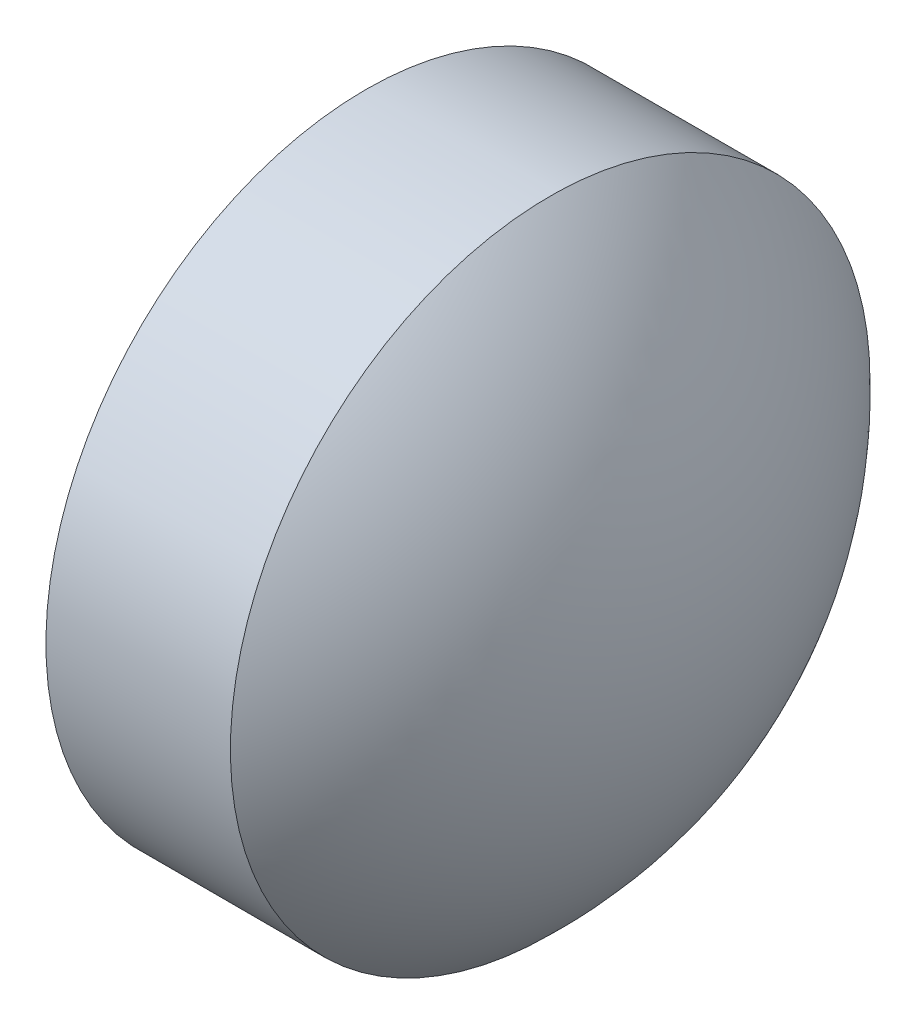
SolidWorks part; units mm, degrees
ref_plane "Vorne" through (0, 0, 0) normal (0, 0, 1) x (1, 0, 0)
ref_plane "Oben" through (0, 0, 0) normal (0, 1, 0) x (1, 0, 0)
ref_plane "Rechts" through (0, 0, 0) normal (1, 0, 0) x (0, 0, -1)
sketch "Skizze1" plane through (0, 0, 0) normal (0, 0, 1) x (1, 0, 0)
  line L0 (0, 0) -> (12.445, 0) construction
  line L1 (0.4954, 1.75) -> (1.505, 1.75) construction
  line L2 (0, 0) -> (2.26, 0)
  line L3 (0.4954, 1.75) -> (1.505, 1.75)
  line L4 (0, 0) -> (-0.9635, 0) construction
  line L5 (0, 0) -> (-0.9635, 0) construction
  arc A0 (2.26, 0) -> (1.505, 1.75) centre (-0.1457, 0) ccw construction
  arc A1 (0.4954, 1.75) -> (0, 0) centre (3.3385, 0) ccw construction
  arc A2 (2.26, 0) -> (1.505, 1.75) centre (-0.1457, 0) ccw
  arc A3 (0.4954, 1.75) -> (0, 0) centre (3.3385, 0) ccw
revolve "Rotation1" add sketch "Skizze1" angle 360 about L5
